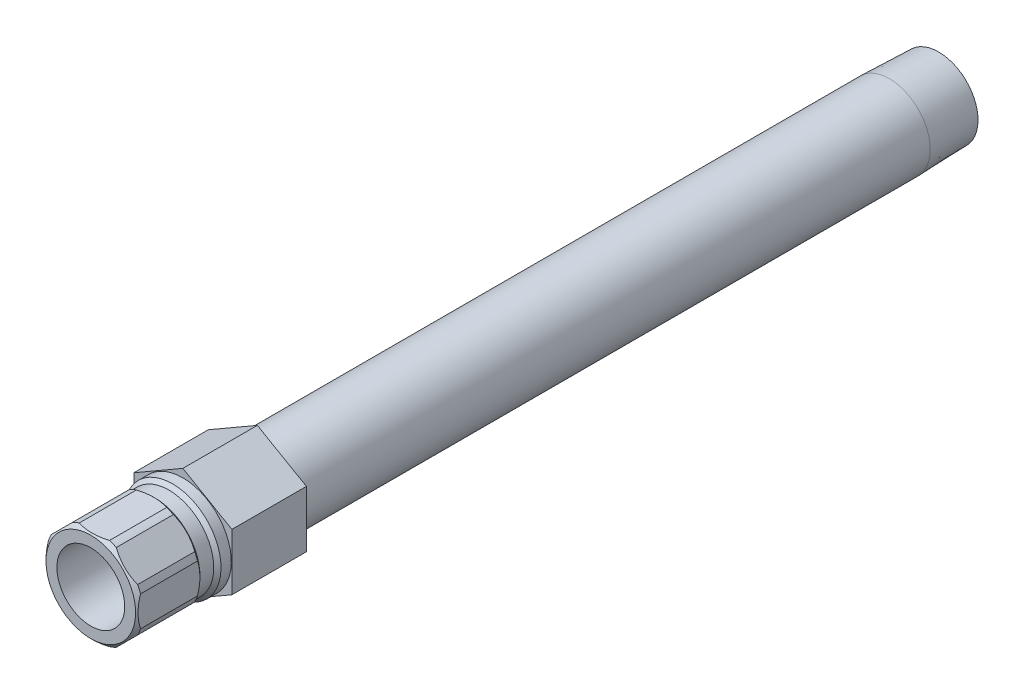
SolidWorks part; units mm, degrees
ref_plane "Front Plane" through (0, 0, 0) normal (0, 0, 1) x (1, 0, 0)
ref_plane "Top Plane" through (0, 0, 0) normal (0, 1, 0) x (1, 0, 0)
ref_plane "Right Plane" through (0, 0, 0) normal (1, 0, 0) x (0, 0, -1)
sketch "Sketch1" plane through (0, 0, 0) normal (1, 0, 0) x (0, 0, -1)
  line L0 (0, 0) -> (-22.479, 0) construction
  line L1 (-19.304, 7.112) -> (-19.304, 9.398)
  line L2 (-5.8166, 9.398) -> (-5.8166, 0) construction
  line L3 (-18.542, 10.16) -> (-6.5786, 10.16)
  line L4 (0, 8.5725) -> (0, 0) construction
  line L5 (-5.8166, 9.398) -> (-2.921, 9.398)
  line L6 (-2.159, 10.16) -> (0, 10.16)
  line L7 (0, 10.16) -> (0, 8.5725)
  line L8 (-5.8166, 9.398) -> (-6.5786, 10.16)
  line L9 (-2.921, 9.398) -> (-2.159, 10.16)
  line L10 (-19.304, 9.398) -> (-18.542, 10.16)
  line L11 (-19.304, 7.112) -> (-1.524, 7.112)
  line L12 (0, 8.5725) -> (148.1582, 8.5725)
  line L13 (148.1582, 8.5725) -> (158.496, 8.2494)
  line L14 (158.496, 8.2494) -> (158.496, 6.2611)
  line L15 (0, 10.16) -> (15.621, 10.16) construction
  line L16 (15.621, 10.16) -> (15.621, 7.112) construction
  line L17 (9.271, 0) -> (0, 0) construction
  line L18 (-1.524, 7.112) -> (-0.6731, 6.2611)
  line L19 (-0.6731, 6.2611) -> (158.496, 6.2611)
  dimension "D1" = 19.304
  dimension "D2" = 2.8956
  dimension "D3" = 0.762
  dimension "D4" = 45
  dimension "D5" = 13.4874
  dimension "D6" = 45
  dimension "D7" = 1.79
  dimension "D8" = 10.3378
  dimension "D9" = 177.8
  dimension "D10" = 3.175
  dimension "D11" = 34.925
  dimension "D12" = 14.224
  dimension "D13" = 17.145
  dimension "D14" = 20.32
  dimension "D15" = 12.5222
  dimension "D16" = 17.78
revolve "Revolve1" add sketch "Sketch1" angle 360 about L0
sketch "Sketch2" plane through (0, 0, 0) normal (0, 0, 1) x (1, 0, 0)
  line L1 (-10.287, 5.9392) -> (-10.287, -5.9392)
  line L2 (-10.287, -5.9392) -> (0, -11.8784)
  line L3 (0, -11.8784) -> (10.287, -5.9392)
  line L4 (10.287, -5.9392) -> (10.287, 5.9392)
  line L5 (10.287, 5.9392) -> (0, 11.8784)
  line L6 (0, 11.8784) -> (-10.287, 5.9392)
  circle A0 centre (0, 0) radius 10.287 construction
  circle A1 centre (0, 0) radius 6.2611 construction
  circle A2 centre (0, 0) radius 6.2611
  dimension "D1" = 20.574
extrude "Boss-Extrude1" add sketch "Sketch2" against normal up to vertex (15.621 mm away) from vertex at 0
sketch "Sketch3" plane through (0, 0, 0) normal (0, 0, 1) x (1, 0, 0)
  line L1 (9.652, -3.998) -> (9.652, 3.998)
  line L2 (9.652, 3.998) -> (3.998, 9.652)
  line L3 (3.998, 9.652) -> (-3.998, 9.652)
  line L4 (-3.998, 9.652) -> (-9.652, 3.998)
  line L5 (-9.652, 3.998) -> (-9.652, -3.998)
  line L6 (-9.652, -3.998) -> (-3.998, -9.652)
  line L7 (-3.998, -9.652) -> (3.998, -9.652)
  line L8 (3.998, -9.652) -> (9.652, -3.998)
  circle A0 centre (0, 0) radius 9.652 construction
  dimension "D1" = 19.304
extrude "Cut-Extrude1" cut sketch "Sketch3" along normal through all from vertex at 5.8166 flip side to cut
